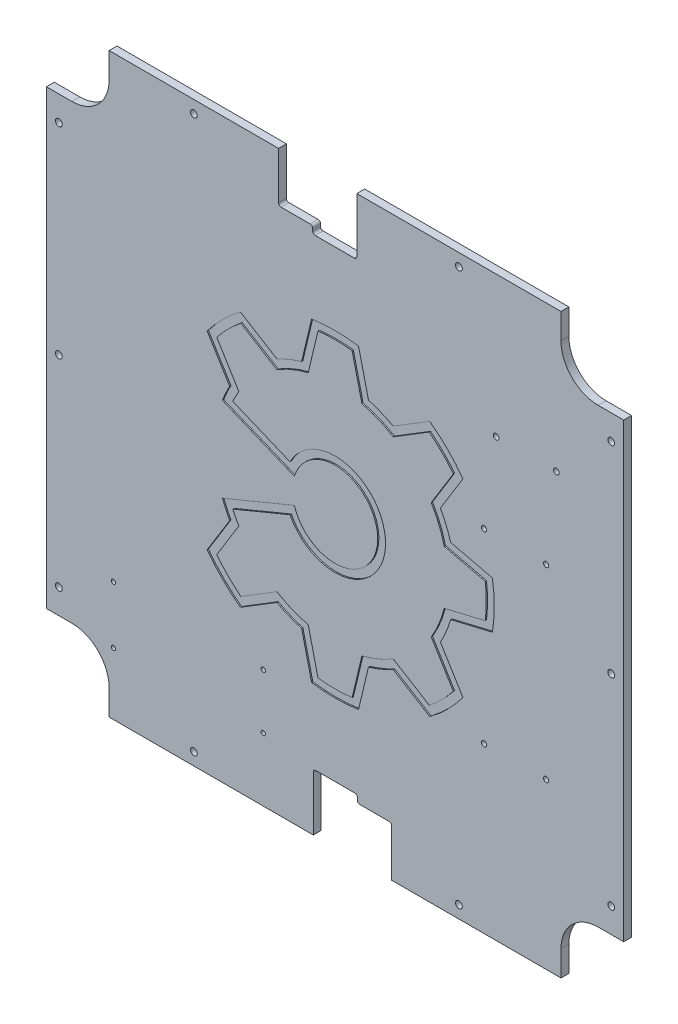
SolidWorks part; units mm, degrees
ref_plane "Front Plane" through (0, 0, 0) normal (0, 0, 1) x (1, 0, 0)
ref_plane "Top Plane" through (0, 0, 0) normal (0, 1, 0) x (1, 0, 0)
ref_plane "Right Plane" through (0, 0, 0) normal (1, 0, 0) x (0, 0, -1)
sketch "Sketch1" plane through (0, 0, 0) normal (0, 0, 1) x (1, 0, 0)
  line L0 (182, -212) -> (212, -212)
  line L1 (-182, -232.5) -> (-17.5, -232.5)
  line L2 (-232.5, -182) -> (-232.5, 0)
  line L3 (212, -212) -> (212, -182)
  line L4 (232.5, -182) -> (232.5, 0)
  line L5 (45.5, -232.5) -> (182, -232.5)
  line L6 (-232.5, 0) -> (232.5, 0) construction
  line L7 (-182, -212) -> (-212, -212)
  line L8 (-212, -212) -> (-212, -182)
  line L9 (232.5, 182) -> (232.5, 0)
  line L10 (232.5, 182) -> (212, 182)
  line L11 (212, 212) -> (212, 182)
  line L12 (182, 212) -> (212, 212)
  line L13 (182, 232.5) -> (182, 212)
  line L14 (182, 232.5) -> (17.5, 232.5)
  line L15 (17.5, 232.5) -> (17.5, 186.5)
  line L16 (-45.5, 186.5) -> (17.5, 186.5)
  line L17 (-45.5, 232.5) -> (-45.5, 186.5)
  line L18 (-45.5, 232.5) -> (-182, 232.5)
  line L19 (-182, 232.5) -> (-182, 212)
  line L20 (-182, 212) -> (-212, 212)
  line L21 (232.5, -182) -> (212, -182)
  line L22 (182, -232.5) -> (182, -212)
  line L23 (-212, 212) -> (-212, 182)
  line L24 (45.5, -232.5) -> (45.5, -186.5)
  line L25 (45.5, -186.5) -> (-17.5, -186.5)
  line L26 (-17.5, -232.5) -> (-17.5, -186.5)
  line L27 (-232.5, 182) -> (-212, 182)
  line L28 (-232.5, 182) -> (-232.5, 0)
  line L29 (-232.5, -182) -> (-212, -182)
  line L30 (-182, -232.5) -> (-182, -212)
  line L31 (0, 0) -> (0, -232.5) construction
  line L32 (-116.5, 222.5) -> (102.5, 222.5) construction
  circle A0 centre (-222.5, -162) radius 2.75
  circle A1 centre (222.5, -162) radius 2.75
  circle A2 centre (222.5, 162) radius 2.75
  circle A3 centre (-222.5, 162) radius 2.75
  circle A4 centre (-222.5, 0) radius 2.75
  circle A5 centre (222.5, 0) radius 2.75
  circle A6 centre (-113.75, 222.5) radius 2.75
  circle A7 centre (99.75, 222.5) radius 2.75
  circle A8 centre (99.75, -222.5) radius 2.75
  circle A9 centre (-113.75, -222.5) radius 2.75
  point P0 (0, 0)
  point P3 (0, 0)
  point P38 (0, 0)
  point P40 (14, -186.5)
  point P55 (-113.75, 232.5)
  point P56 (99.75, 232.5)
  point P68 (0, 0)
  dimension "D21" = 20.5
  dimension "D22" = 20.5
  dimension "D23" = 232.5
  dimension "D7" = 5.5
  dimension "D8" = 10
  dimension "D9" = 20
  dimension "D13" = 10
  dimension "D3" = 50.5
  dimension "D4" = 20.5
  dimension "D5" = 20.5
  dimension "D6" = 2
  dimension "D10" = 14
  dimension "D11" = 50.5
  dimension "D12" = 50.5
  dimension "D15" = 63
  dimension "D16" = 46
  dimension "D18" = 50.5
  dimension "D20" = 465
extrude "Boss-Extrude1" add sketch "Sketch1" along normal blind 6.35
sketch "Sketch4" plane through (0, 0, 6.35) normal (0, 0, 1) x (1, 0, 0)
  line L1 (45.5, -186.5) -> (18, -186.5)
  line L2 (45.5, -186.5) -> (45.5, -192.5)
  line L3 (45.5, -192.5) -> (18, -192.5)
  line L4 (18, -186.5) -> (18, -192.5)
  line L5 (-45.5, 186.5) -> (-18, 186.5)
  line L6 (-45.5, 186.5) -> (-45.5, 192.5)
  line L7 (-45.5, 192.5) -> (-18, 192.5)
  line L8 (-18, 186.5) -> (-18, 192.5)
  dimension "D1" = 27.5
  dimension "D2" = 6
extrude "Boss-Extrude2" add sketch "Sketch4" against normal up to surface (6.35 mm away)
sketch "Sketch2" plane through (0, 0, 6.35) normal (0, 0, 1) x (1, 0, 0)
  line L0 (232.5, 182) -> (212, 182) construction
  line L1 (212, 212) -> (182, 212) construction
  line L2 (212, 182) -> (212, 212) construction
  line L3 (212, 212) -> (182, 212)
  line L4 (212, 182) -> (212, 212)
  line L5 (182, -212) -> (212, -212) construction
  line L6 (212, -212) -> (212, -182) construction
  line L7 (182, -212) -> (212, -212)
  line L8 (212, -212) -> (212, -182)
  line L9 (-212, -212) -> (-182, -212) construction
  line L10 (-212, -182) -> (-212, -212) construction
  line L11 (-212, 212) -> (-212, 182) construction
  line L12 (-182, 212) -> (-212, 212) construction
  line L13 (-212, -212) -> (-182, -212)
  line L14 (-212, -182) -> (-212, -212)
  line L15 (-212, 212) -> (-212, 182)
  line L16 (-182, 212) -> (-212, 212)
  arc A0 (182, 212) -> (212, 182) centre (212, 212) ccw
  arc A1 (212, -182) -> (182, -212) centre (212, -212) ccw
  arc A2 (-212, 182) -> (-182, 212) centre (-212, 212) ccw
  arc A3 (-182, -212) -> (-212, -182) centre (-212, -212) ccw
extrude "Cut-Extrude1" cut sketch "Sketch2" against normal up to surface (6.35 mm away) contours A0 L4 L3
sketch "Sketch3" plane through (0, 0, 6.35) normal (0, 0, 1) x (1, 0, 0)
  line L0 (0, 0) -> (125, 0) construction
  line L1 (0, 0) -> (123.9306, -16.3158) construction
  line L2 (0, 0) -> (115.4849, -47.8354) construction
  line L3 (0, 0) -> (120.7407, -32.3524) construction
  line L4 (123.9306, -16.3158) -> (90.5555, -24.2643) construction
  line L5 (123.9306, 16.3158) -> (90.5555, 24.2643) construction
  line L6 (76.0952, -99.1692) -> (46.875, -81.1899) construction
  line L7 (99.1692, -76.0952) -> (81.1899, -46.875) construction
  line L8 (-16.3158, -123.9306) -> (-24.2643, -90.5555) construction
  line L9 (16.3158, -123.9306) -> (24.2643, -90.5555) construction
  line L10 (-99.1692, -76.0952) -> (-81.1899, -46.875) construction
  line L11 (-76.0952, -99.1692) -> (-46.875, -81.1899) construction
  line L12 (-82.4139, 37.5736) -> (-36.2491, 18.4515)
  line L13 (-95.3084, 75.8792) -> (-77.4822, 46.9078)
  line L14 (-76.0952, 99.1692) -> (-46.875, 81.1899) construction
  line L15 (-99.1692, 76.0952) -> (-81.1899, 46.875) construction
  line L16 (16.3158, 123.9306) -> (24.2643, 90.5555) construction
  line L17 (-16.3158, 123.9306) -> (-24.2643, 90.5555) construction
  line L18 (99.1692, 76.0952) -> (81.1899, 46.875) construction
  line L19 (76.0952, 99.1692) -> (46.875, 81.1899) construction
  line L20 (0, 0) -> (88.3883, -88.3883) construction
  line L21 (0, 0) -> (0, -125) construction
  line L22 (0, 0) -> (-88.3883, -88.3883) construction
  line L23 (0, 0) -> (-125, 0) construction
  line L24 (0, 0) -> (-88.3883, 88.3883) construction
  line L25 (0, 0) -> (0, 125) construction
  line L26 (0, 0) -> (88.3883, 88.3883) construction
  line L27 (-86.6137, 35.8766) -> (-34.6455, 14.3506) construction
  line L28 (-86.6137, -35.8766) -> (-34.6455, -14.3506) construction
  line L29 (-75.8792, 95.3084) -> (-46.9078, 77.4822)
  line L30 (-123.9306, 16.3158) -> (-90.5555, 24.2643)
  line L31 (-123.9306, -16.3158) -> (-90.5555, -24.2643)
  line L32 (-13.7385, 121.0479) -> (-21.6193, 87.957)
  line L33 (13.7385, 121.0479) -> (21.6193, 87.957)
  line L34 (75.8792, 95.3084) -> (46.9078, 77.4822)
  line L35 (95.3084, 75.8792) -> (77.4822, 46.9078)
  line L36 (121.0479, 13.7385) -> (87.957, 21.6193)
  line L37 (121.0479, -13.7385) -> (87.957, -21.6193)
  line L38 (95.3084, -75.8792) -> (77.4822, -46.9078)
  line L39 (75.8792, -95.3084) -> (46.9078, -77.4822)
  line L40 (13.7385, -121.0479) -> (21.6193, -87.957)
  line L41 (-13.7385, -121.0479) -> (-21.6193, -87.957)
  line L42 (-75.8792, -95.3084) -> (-46.9078, -77.4822)
  line L43 (-95.3084, -75.8792) -> (-77.4822, -46.9078)
  line L44 (-82.4139, -37.5736) -> (-36.2491, -18.4515)
  line L45 (-90.714, 34.1384) -> (-32.7912, 10.146)
  line L46 (-103.0085, 76.2763) -> (-84.8748, 46.8052)
  line L47 (-76.2763, 103.0085) -> (-46.8052, 84.8748)
  line L48 (-18.9025, 126.7735) -> (-26.9193, 93.1118)
  line L49 (18.9025, 126.7735) -> (26.9193, 93.1118)
  line L50 (76.2763, 103.0085) -> (46.8052, 84.8748)
  line L51 (103.0085, 76.2763) -> (84.8748, 46.8052)
  line L52 (126.7735, 18.9025) -> (93.1118, 26.9193)
  line L53 (126.7735, -18.9025) -> (93.1118, -26.9193)
  line L54 (103.0085, -76.2763) -> (84.8748, -46.8052)
  line L55 (76.2763, -103.0085) -> (46.8052, -84.8748)
  line L56 (18.9025, -126.7735) -> (26.9193, -93.1118)
  line L57 (-18.9025, -126.7735) -> (-26.9193, -93.1118)
  line L58 (-76.2763, -103.0085) -> (-46.8052, -84.8748)
  line L59 (-103.0085, -76.2763) -> (-84.8748, -46.8052)
  line L60 (-90.714, -34.1384) -> (-32.7912, -10.146)
  line L61 (55, 0) -> (-55, 0) construction
  arc A0 (-34.6455, -14.3506) -> (-34.6455, 14.3506) centre (0, 0) ccw construction
  arc A1 (99.1692, 76.0952) -> (76.0952, 99.1692) centre (0, 0) ccw construction
  arc A2 (-36.2491, -18.4515) -> (-36.2491, 18.4515) centre (0, 0) ccw
  arc A3 (90.5555, 24.2643) -> (81.1899, 46.875) centre (0, 0) ccw construction
  arc A4 (81.1899, -46.875) -> (90.5555, -24.2643) centre (0, 0) ccw construction
  arc A5 (24.2643, -90.5555) -> (46.875, -81.1899) centre (0, 0) ccw construction
  arc A6 (-46.875, -81.1899) -> (-24.2643, -90.5555) centre (0, 0) ccw construction
  arc A7 (-86.6137, -35.8766) -> (-81.1899, -46.875) centre (0, 0) ccw construction
  arc A8 (-81.1899, 46.875) -> (-86.6137, 35.8766) centre (0, 0) ccw construction
  arc A9 (-24.2643, 90.5555) -> (-46.875, 81.1899) centre (0, 0) ccw construction
  arc A10 (46.875, 81.1899) -> (24.2643, 90.5555) centre (0, 0) ccw construction
  arc A11 (115.4849, -47.8354) -> (120.7407, -32.3524) centre (0, 0) ccw construction
  arc A12 (123.9306, -16.3158) -> (123.9306, 16.3158) centre (0, 0) ccw construction
  arc A13 (76.0952, -99.1692) -> (99.1692, -76.0952) centre (0, 0) ccw construction
  arc A14 (-16.3158, -123.9306) -> (16.3158, -123.9306) centre (0, 0) ccw construction
  arc A15 (-99.1692, -76.0952) -> (-76.0952, -99.1692) centre (0, 0) ccw construction
  arc A16 (-77.4822, 46.9078) -> (-82.4139, 37.5736) centre (0, 0) ccw
  arc A17 (-76.0952, 99.1692) -> (-99.1692, 76.0952) centre (0, 0) ccw construction
  arc A18 (16.3158, 123.9306) -> (-16.3158, 123.9306) centre (0, 0) ccw construction
  arc A19 (-75.8792, 95.3084) -> (-95.3084, 75.8792) centre (0, 0) ccw
  arc A20 (-21.6193, 87.957) -> (-46.9078, 77.4822) centre (0, 0) ccw
  arc A21 (13.7385, 121.0479) -> (-13.7385, 121.0479) centre (0, 0) ccw
  arc A22 (46.9078, 77.4822) -> (21.6193, 87.957) centre (0, 0) ccw
  arc A23 (95.3084, 75.8792) -> (75.8792, 95.3084) centre (0, 0) ccw
  arc A24 (87.957, 21.6193) -> (77.4822, 46.9078) centre (0, 0) ccw
  arc A25 (121.0479, -13.7385) -> (121.0479, 13.7385) centre (0, 0) ccw
  arc A26 (77.4822, -46.9078) -> (87.957, -21.6193) centre (0, 0) ccw
  arc A27 (75.8792, -95.3084) -> (95.3084, -75.8792) centre (0, 0) ccw
  arc A28 (21.6193, -87.957) -> (46.9078, -77.4822) centre (0, 0) ccw
  arc A29 (-13.7385, -121.0479) -> (13.7385, -121.0479) centre (0, 0) ccw
  arc A30 (-46.9078, -77.4822) -> (-21.6193, -87.957) centre (0, 0) ccw
  arc A31 (-95.3084, -75.8792) -> (-75.8792, -95.3084) centre (0, 0) ccw
  arc A32 (-82.4139, -37.5736) -> (-77.4822, -46.9078) centre (0, 0) ccw
  arc A33 (-32.7912, -10.146) -> (-32.7912, 10.146) centre (0, 0) ccw
  arc A34 (-84.8748, 46.8052) -> (-90.714, 34.1384) centre (0, 0) ccw
  arc A35 (-76.2763, 103.0085) -> (-103.0085, 76.2763) centre (0, 0) ccw
  arc A36 (-26.9193, 93.1118) -> (-46.8052, 84.8748) centre (0, 0) ccw
  arc A37 (18.9025, 126.7735) -> (-18.9025, 126.7735) centre (0, 0) ccw
  arc A38 (46.8052, 84.8748) -> (26.9193, 93.1118) centre (0, 0) ccw
  arc A39 (103.0085, 76.2763) -> (76.2763, 103.0085) centre (0, 0) ccw
  arc A40 (93.1118, 26.9193) -> (84.8748, 46.8052) centre (0, 0) ccw
  arc A41 (126.7735, -18.9025) -> (126.7735, 18.9025) centre (0, 0) ccw
  arc A42 (84.8748, -46.8052) -> (93.1118, -26.9193) centre (0, 0) ccw
  arc A43 (76.2763, -103.0085) -> (103.0085, -76.2763) centre (0, 0) ccw
  arc A44 (26.9193, -93.1118) -> (46.8052, -84.8748) centre (0, 0) ccw
  arc A45 (-18.9025, -126.7735) -> (18.9025, -126.7735) centre (0, 0) ccw
  arc A46 (-46.8052, -84.8748) -> (-26.9193, -93.1118) centre (0, 0) ccw
  arc A47 (-103.0085, -76.2763) -> (-76.2763, -103.0085) centre (0, 0) ccw
  arc A48 (-90.714, -34.1384) -> (-84.8748, -46.8052) centre (0, 0) ccw
  point P44 (0, 0)
extrude "Cut-Extrude2" cut sketch "Sketch3" against normal blind 1
fillet "Fillet1" radius 2 8 edges at (17.5, 186.5, 3.175) (-18, 186.5, 3.175) (-18, 192.5, 3.175) (-45.5, 192.5, 3.175) (45.5, -192.5, 3.175) (18, -192.5, 3.175) (18, -186.5, 3.175) (-17.5, -186.5, 3.175)
sketch "Sketch5" plane through (0, 0, 0) normal (0, 0, -1) x (-1, 0, 0)
  line L0 (-177.25, 119) -> (-178.25, 119) construction
  arc A0 (-177.25, 116.75) -> (-177.25, 121.25) centre (-177.25, 119) ccw construction
  circle A1 centre (-129.75, 119) radius 2.25 construction
  circle A3 centre (57.83, -137.3) radius 1.75 construction
  circle A5 centre (178.5, -136.3) radius 1.75 construction
  arc A6 (-177.25, 116.75) -> (-177.25, 121.25) centre (-177.25, 119) ccw construction
  circle A7 centre (-129.75, 119) radius 2.25
  circle A9 centre (57.83, -137.3) radius 1.75
  circle A11 centre (178.5, -136.3) radius 1.75
  circle A12 centre (-178.25, 119) radius 2.25
  circle A13 centre (178.5, -182.5) radius 1.75 construction
  circle A14 centre (57.83, -181.5) radius 1.75 construction
  circle A15 centre (178.5, -182.5) radius 1.75
  circle A16 centre (57.83, -181.5) radius 1.75
  circle A17 centre (-170, 50) radius 2.1 construction
  circle A18 centre (-120, 50) radius 2.1 construction
  circle A19 centre (-170, -100) radius 2.1 construction
  circle A20 centre (-120, -100) radius 2.1 construction
  circle A21 centre (-170, 50) radius 2.1
  circle A22 centre (-120, 50) radius 2.1
  circle A23 centre (-170, -100) radius 2.1
  circle A24 centre (-120, -100) radius 2.1
  dimension "D1" = 1
extrude "Cut-Extrude3" cut sketch "Sketch5" against normal through all
equation "\"D4@Sketch3\"=.75*\"D3@Sketch3\""
equation "\"D5@Sketch3\"=.3*\"D3@Sketch3\""
equation "\"D2@Sketch3\"=\"D1@Sketch3\"/3"
equation "\"D6@Sketch3\"=\"D1@Sketch3\"*(2/3)"
